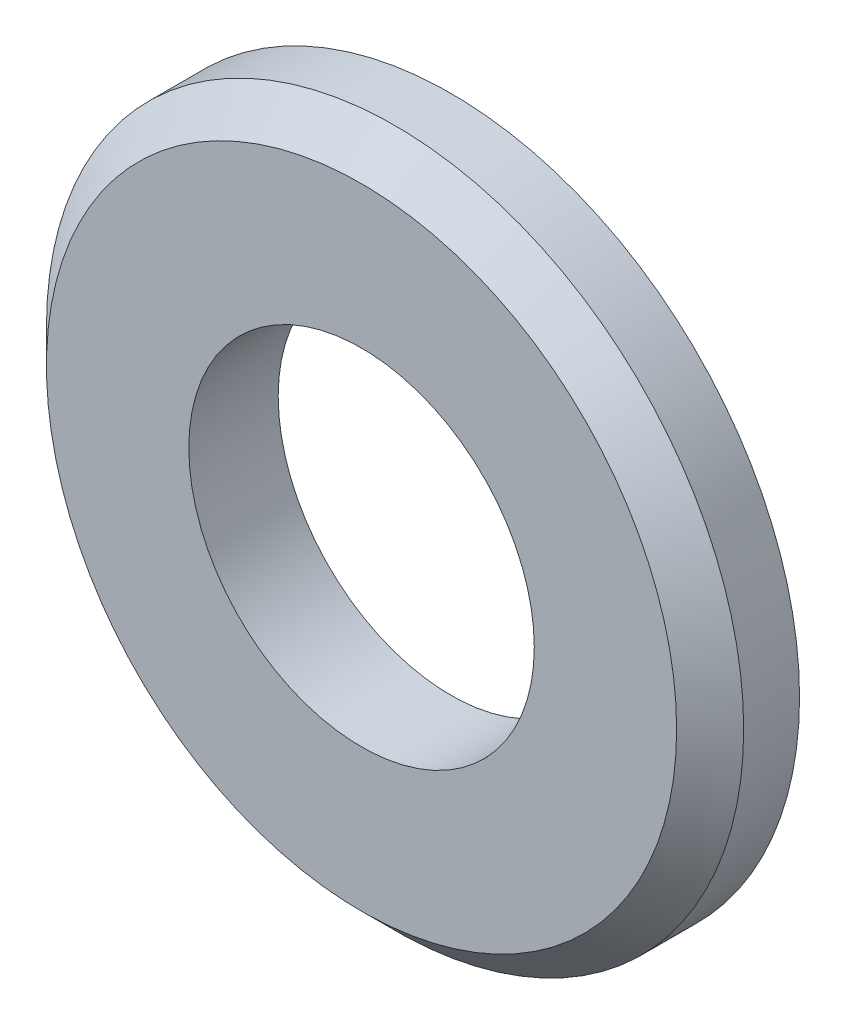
SolidWorks part; units mm, degrees
ref_plane "Front Plane" through (0, 0, 0) normal (0, 0, 1) x (1, 0, 0)
ref_plane "Top Plane" through (0, 0, 0) normal (0, 1, 0) x (1, 0, 0)
ref_plane "Right Plane" through (0, 0, 0) normal (1, 0, 0) x (0, 0, -1)
sketch "Sketch1" plane through (0, 0, 0) normal (0, 0, 1) x (1, 0, 0)
  circle A0 centre (0, 0) radius 1.9634
  circle A1 centre (0, 0) radius 3.9624
  dimension "D1" = 7.9248
  dimension "D2" = 3.9268
extrude "Boss-Extrude1" add sketch "Sketch1" along normal blind 1.016
chamfer "Chamfer1" distance 0.381 angle 45 1 edges at (3.9624, 0, 1.016)
